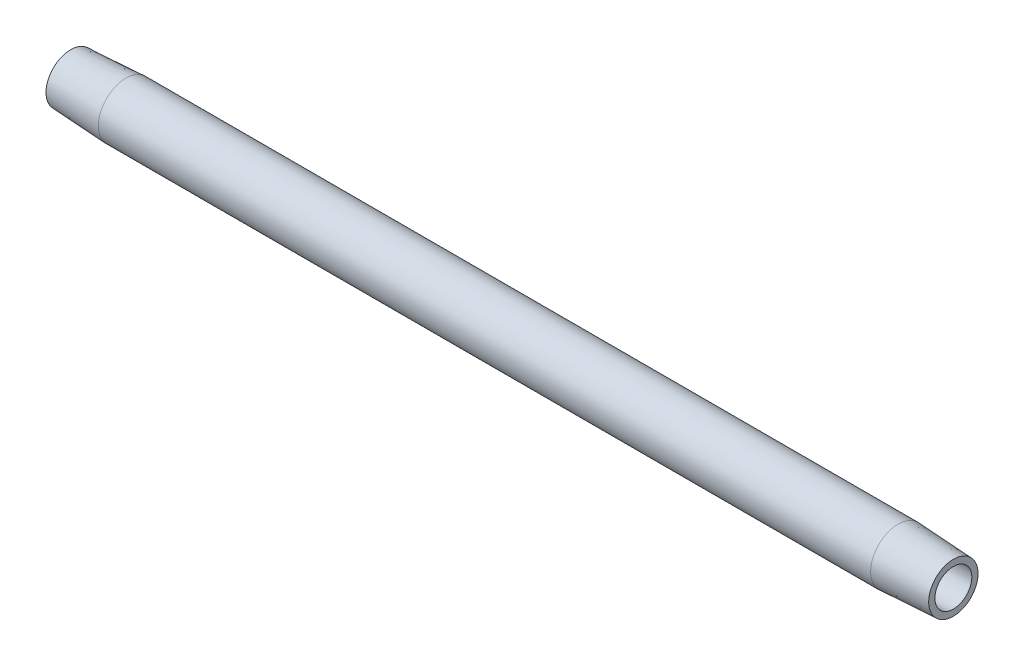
SolidWorks part; units mm, degrees
ref_plane "Front Plane" through (0, 0, 0) normal (0, 0, 1) x (1, 0, 0)
ref_plane "Top Plane" through (0, 0, 0) normal (0, 1, 0) x (1, 0, 0)
ref_plane "Right Plane" through (0, 0, 0) normal (1, 0, 0) x (0, 0, -1)
sketch "Sketch2" plane through (0, 0, 0) normal (0, 0, 1) x (1, 0, 0)
  line L0 (0.4761, 0) -> (50000.4761, 0) construction
  line L1 (0, -11.3625) -> (0, 49988.6375) construction
  line L7 (7.9375, 3.9687) -> (0, 3.5528)
  line L8 (119.0625, 3.9688) -> (7.9375, 3.9687)
  line L9 (127, 3.5528) -> (119.0625, 3.9688)
  line L10 (127, 2.6543) -> (127, 3.5528)
  line L11 (127, 2.6543) -> (0, 2.6543)
  line L12 (0, 3.5528) -> (0, 2.6543)
  dimension "D1" = 5.3086
  dimension "D2" = 7.9375
  dimension "D3" = 3
  dimension "D4" = 3
  dimension "D5" = 7.9375
  dimension "D6" = 7.9375
  dimension "D7" = 127
revolve "Revolve1" add sketch "Sketch2" angle 360 about L0
